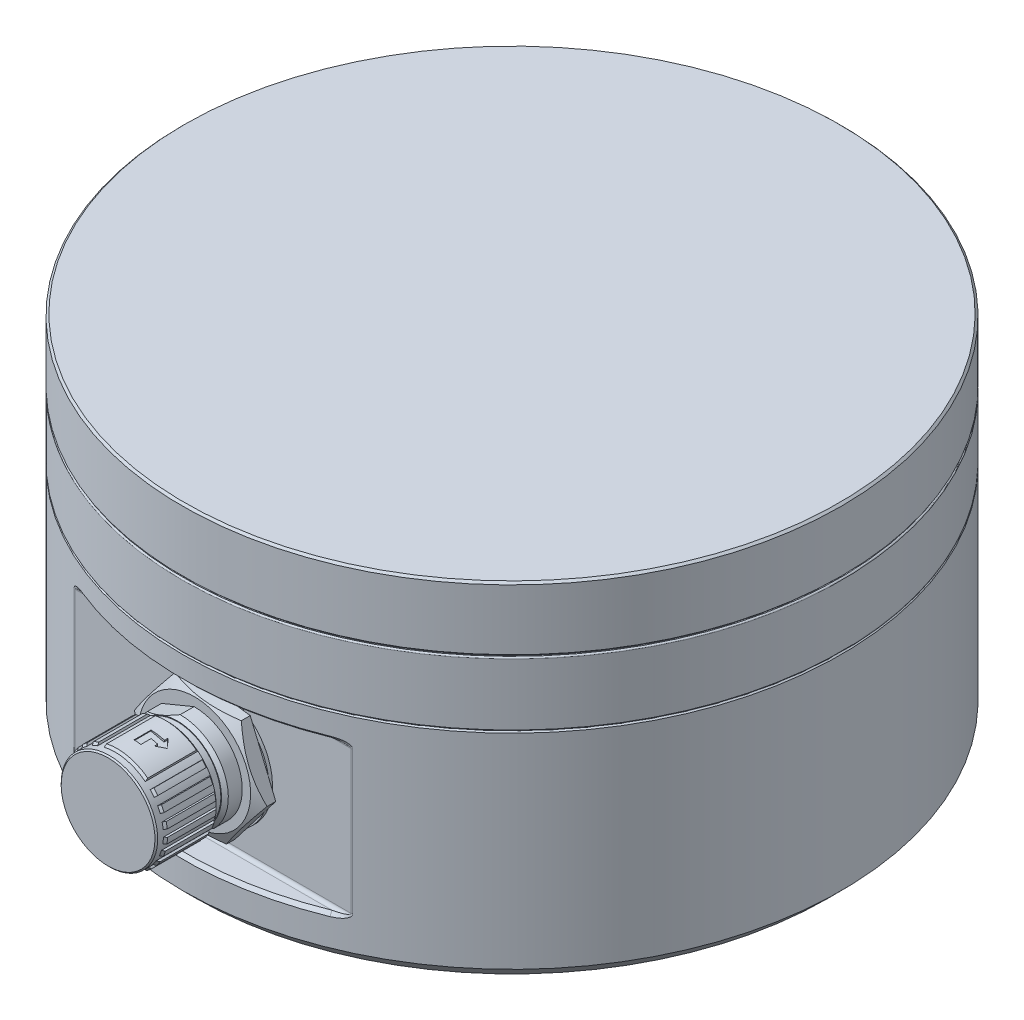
SolidWorks part; units mm, degrees
ref_plane "前视基准面" through (0, 0, 0) normal (0, 0, 1) x (1, 0, 0)
ref_plane "上视基准面" through (0, 0, 0) normal (0, 1, 0) x (1, 0, 0)
ref_plane "右视基准面" through (0, 0, 0) normal (1, 0, 0) x (0, 0, -1)
imported_body "C20末端法兰-1-solid1"
imported_body "航插组件-1/080108-03-003-1-solid1"
imported_body "航插组件-1/末端航插帽-C-1-solid1"
imported_body "航插组件-1/O型密封圈8x1-1-solid1"
imported_body "C20末端法兰转接件-1-solid1"
imported_body "C20散光环-1-solid1"
imported_body "LF10WBR-C-1-solid1"
imported_body "末端航插2-1-solid1"
combine bodies "组合1" operation type add bodies to combine 107 111 109 106 110 108 112 113
sketch "草图1" plane through (0, 57.8, 0) normal (0, 1, 0) x (1, 0, 0)
  circle A0 centre (0, 0) radius 47.4218
extrude "凸台-拉伸1" add sketch "草图1" against normal blind 10
